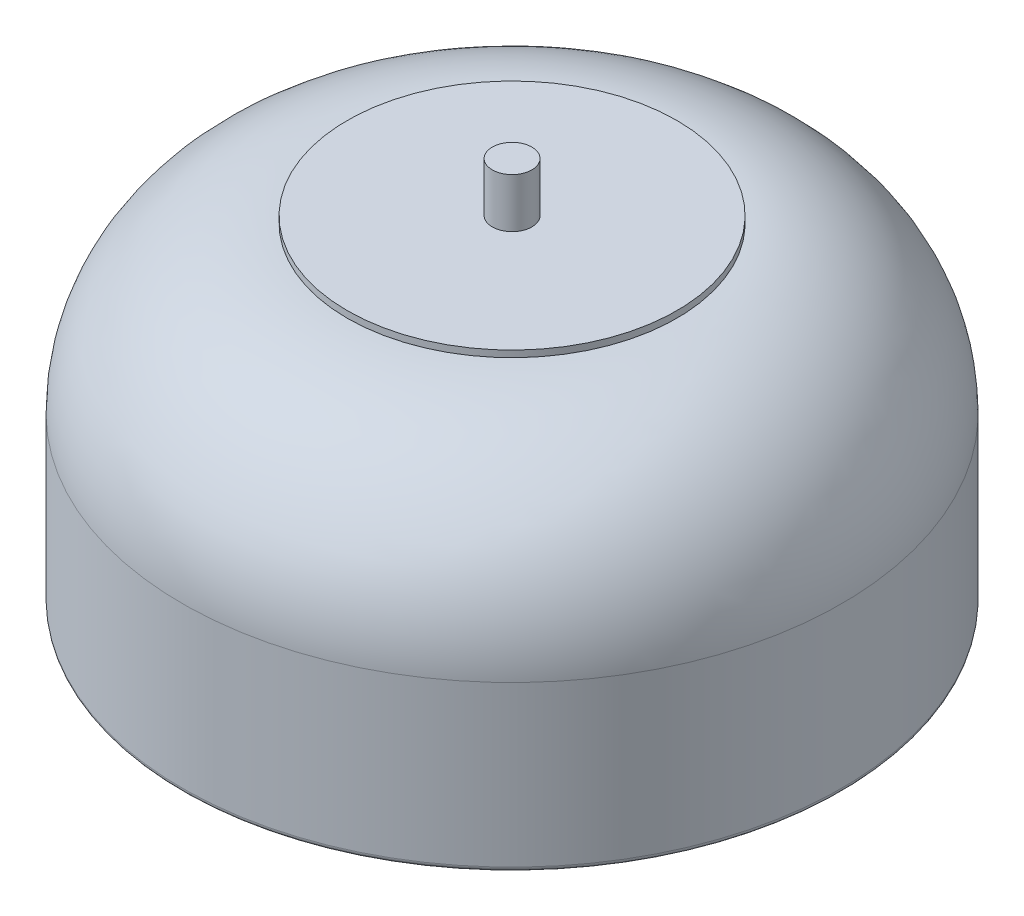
SolidWorks part; units mm, degrees
ref_plane "Alzado" through (0, 0, 0) normal (0, 0, 1) x (1, 0, 0)
ref_plane "Planta" through (0, 0, 0) normal (0, 1, 0) x (1, 0, 0)
ref_plane "Vista lateral" through (0, 0, 0) normal (1, 0, 0) x (0, 0, -1)
sketch "Croquis1" plane through (0, 0, 0) normal (0, 0, 1) x (1, 0, 0)
  line L0 (0, 30) -> (0, -70)
  line L1 (50, 30) -> (0, 30)
  line L2 (100, -20) -> (100, -70)
  line L3 (100, -70) -> (0, -70)
  line L5 (100, 30) -> (0, 0) construction
  line L6 (100, -70) -> (0, 0) construction
  arc A0 (50, 30) -> (100, -20) centre (50, -20) cw
  point P0 (0, 0)
  dimension "D3" = 50
  dimension "D1" = 100
  dimension "D2" = 100
revolve "Revolución1" add sketch "Croquis1" angle 360 about L0
shell "Vaciado1" thickness 3
fillet "Redondeo1" radius 1.5 2 edges at (-100, -70, 0) (-97, -70, 0)
sketch "Croquis2" plane through (0, 27, 0) normal (0, -1, 0) x (1, 0, 0)
  circle A0 centre (0, 0) radius 50
  dimension "D1" = 100
extrude "Saliente-Extruir1" add sketch "Croquis2" along normal blind 2 separate body
sketch "Croquis3" plane through (0, 25, 0) normal (0, -1, 0) x (1, 0, 0)
  circle A1 centre (0, 0) radius 50
  circle A2 centre (0, 0) radius 50
  dimension "D1" = 0
extrude "Saliente-Extruir2" add sketch "Croquis3" along normal blind 20 separate body
sketch "Croquis4" plane through (0, 5, 0) normal (0, -1, 0) x (1, 0, 0)
  circle A1 centre (0, 0) radius 50
  circle A2 centre (0, 0) radius 50
  dimension "D1" = 0
extrude "Saliente-Extruir3" add sketch "Croquis4" along normal blind 15 separate body
fillet "Redondeo2" radius 10 1 edges at (0, -10, -50)
sketch "Croquis5" plane through (0, 30, 0) normal (0, 1, 0) x (1, 0, 0)
  circle A0 centre (0, 0) radius 50
  dimension "D1" = 100
extrude "Saliente-Extruir4" add sketch "Croquis5" along normal blind 2 separate body
sketch "Croquis6" plane through (0, 32, 0) normal (0, 1, 0) x (1, 0, 0)
  circle A0 centre (0, 0) radius 6
  dimension "D1" = 12
extrude "Saliente-Extruir5" add sketch "Croquis6" along normal blind 15
